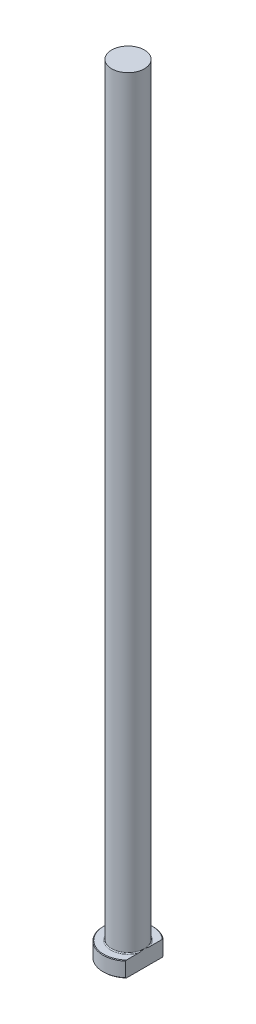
SolidWorks part; units mm, degrees
ref_plane "Front Plane" through (0, 0, 0) normal (0, 0, 1) x (1, 0, 0)
ref_plane "Top Plane" through (0, 0, 0) normal (0, 1, 0) x (1, 0, 0)
ref_plane "Right Plane" through (0, 0, 0) normal (1, 0, 0) x (0, 0, -1)
sketch "Sketch1" plane through (0, 0, 0) normal (0, 0, 1) x (1, 0, 0)
  line L0 (0, 259.9588) -> (0, -15.1925) construction
  line L1 (0, 0) -> (-8, 0)
  line L2 (-8, 0) -> (-8, 5)
  line L3 (-8, 5) -> (-5.25, 5)
  line L4 (-5.25, 5) -> (-5.25, 250)
  line L5 (-5.25, 250) -> (0, 250)
  line L6 (0, 250) -> (0, 0)
  dimension "L" = 250
  dimension "H" = 16
  dimension "T" = 5
  dimension "D" = 10.5
revolve "Revolve1" add sketch "Sketch1" angle 360 about L0
chamfer "Chamfer1" distance 0.2 angle 45 2 edges at (0, 5, 8) (0, 0, 8)
fillet "Fillet1" radius 0.3 1 edges at (0, 5, 5.25)
sketch "Sketch2" plane through (0, 0, 0) normal (0, 1, 0) x (1, 0, 0)
  line L0 (5.25, 6.0363) -> (5.25, -6.0363)
  circle A0 centre (0, 0) radius 8 construction
  arc A1 (5.25, -6.0363) -> (5.25, 6.0363) centre (0, 0) ccw
  circle A2 centre (0, 0) radius 5.25 construction
extrude "KEY" cut sketch "Sketch2" along normal through all
